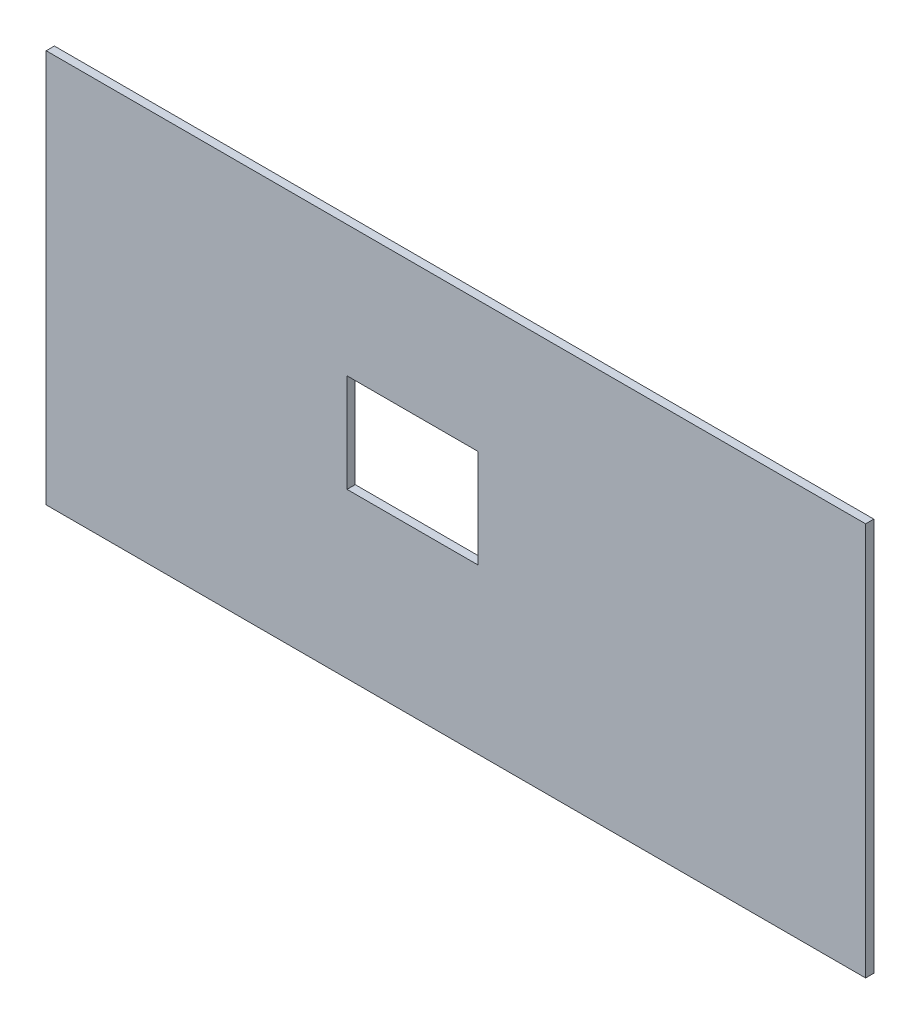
SolidWorks part; units mm, degrees
ref_plane "Front Plane" through (0, 0, 0) normal (0, 0, 1) x (1, 0, 0)
ref_plane "Top Plane" through (0, 0, 0) normal (0, 1, 0) x (1, 0, 0)
ref_plane "Right Plane" through (0, 0, 0) normal (1, 0, 0) x (0, 0, -1)
sketch "Sketch1" plane through (0, 0, 0) normal (0, 0, 1) x (1, 0, 0)
  line L1 (-35.7416, 95.5819) -> (599.2584, 95.5819)
  line L2 (-35.7416, 95.5819) -> (-35.7416, 400.3819)
  line L3 (-35.7416, 400.3819) -> (599.2584, 400.3819)
  line L4 (599.2584, 95.5819) -> (599.2584, 400.3819)
  line L5 (197.409, 222.5819) -> (299.009, 222.5819)
  line L6 (197.409, 222.5819) -> (197.409, 298.7819)
  line L7 (197.409, 298.7819) -> (299.009, 298.7819)
  line L8 (299.009, 222.5819) -> (299.009, 298.7819)
  dimension "D1" = 635
  dimension "D2" = 304.8
  dimension "D3" = 101.6
  dimension "D4" = 76.2
  dimension "D5" = 127
extrude "Boss-Extrude2" add sketch "Sketch1" along normal blind 6.35
